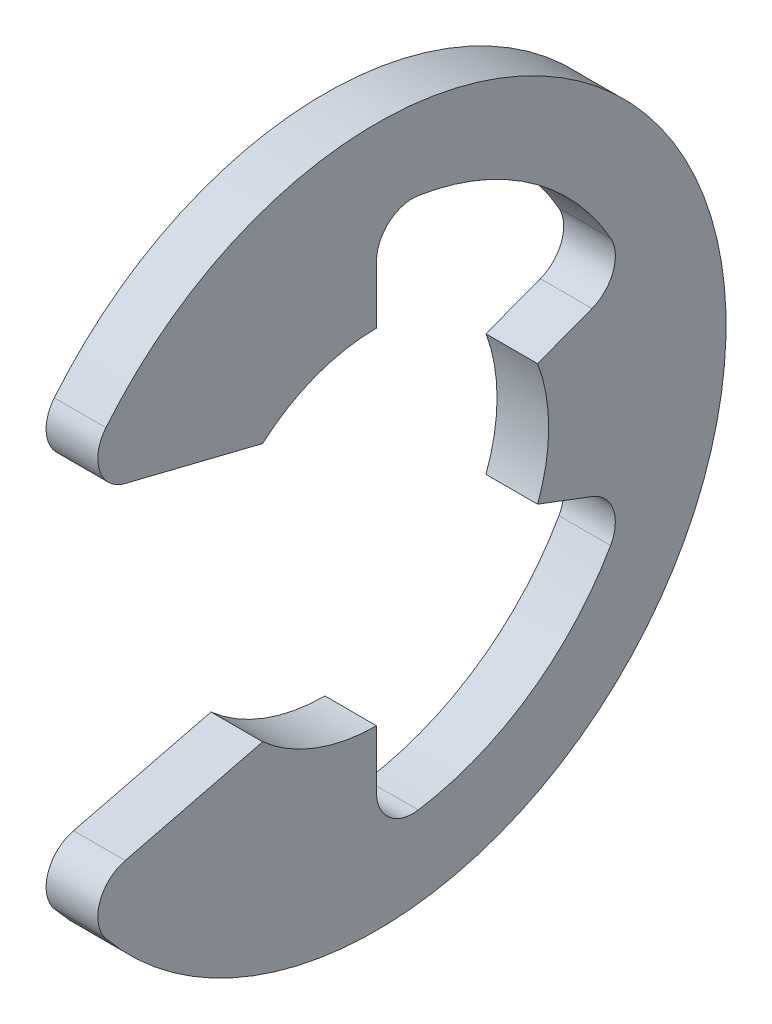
SolidWorks part; units mm, degrees
ref_plane "Front" through (0, 0, 0) normal (0, 0, 1) x (1, 0, 0)
ref_plane "Top" through (0, 0, 0) normal (0, 1, 0) x (1, 0, 0)
ref_plane "Right" through (0, 0, 0) normal (1, 0, 0) x (0, 0, -1)
sketch "Sketch1" plane through (0, 0, 0) normal (1, 0, 0) x (0, 0, -1)
  line L0 (-2.228, -1.2971) -> (-0.84, -0.9525)
  line L1 (-2.228, 1.2971) -> (-0.84, 0.9525)
  line L2 (0, -1.27) -> (0, -1.9861)
  line L3 (0, 1.27) -> (0, 1.9861)
  line L4 (1.188, -0.449) -> (1.8578, -0.7022)
  line L5 (1.188, 0.449) -> (1.8578, 0.7022)
  line L6 (0, 0) -> (-2.7305, 0) construction
  line L7 (1.188, 0.449) -> (1.188, -0.449) construction
  line L8 (0, -1.27) -> (-0.84, -0.9525) construction
  line L9 (0, 2.5781) -> (0, -2.5781) construction
  circle A1 centre (0, 0) radius 2.7305 construction
  circle A2 centre (0, 0) radius 1.27 construction
  arc A3 (-2.228, -1.2971) -> (-2.228, 1.2971) centre (0, 0) ccw
  arc A4 (-0.84, -0.9525) -> (0, -1.27) centre (0, 0) ccw
  arc A5 (-0.84, 0.9525) -> (0, 1.27) centre (0, 0) cw
  arc A6 (1.188, 0.449) -> (1.188, -0.449) centre (0, 0) cw
  arc A7 (0, -1.9861) -> (1.8578, -0.7022) centre (0, 0) ccw
  arc A8 (1.8578, 0.7022) -> (0, 1.9861) centre (0, 0) ccw
extrude "Extrude1" add sketch "Sketch1" along normal mid plane 0.381
fillet "Fillet1" radius 0.2667 6 edges at (0, -1.9861, 0) (0, 1.9861, 0) (0, -1.2971, 2.228) (0, 1.2971, 2.228) (0, -0.7022, -1.8578) (0, 0.7022, -1.8578)
sketch "Sketch3" plane through (0, 0, 0) normal (0, 1, 0) x (1, 0, 0)
  line L0 (0.254, 1.778) -> (0.254, 1.2954)
  line L1 (0.254, 1.2954) -> (-0.254, 1.2954)
  line L2 (-0.254, 1.2954) -> (-0.254, 1.778)
  line L3 (-0.254, 1.778) -> (-3.556, 1.778)
  line L4 (1.524, 0) -> (1.524, 1.5367)
  line L5 (-3.556, 1.778) -> (-3.556, 0)
  line L6 (-3.556, 0) -> (1.524, 0)
  line L8 (1.524, 0) -> (1.524, 1.778) construction
  line L9 (1.524, 1.778) -> (0.254, 1.778) construction
  line L10 (1.524, 0) -> (17.2631, 0) construction
  line L11 (1.524, 1.5367) -> (1.2827, 1.778)
  line L12 (1.2827, 1.778) -> (0.254, 1.778)
  point P2 (0, 1.2954)
  point P5 (0.254, 1.5367)
revolve "Revolve2" [suppressed] add sketch "Sketch3" angle 360 about L10
equation "\"D2@Sketch3\" = \"W@Sketch3\"*10"
equation "\"D1@Sketch3\" = \"D2@Sketch3\"/4"
equation "\"D1@Sketch1\" = (\"OD@Sketch1\"+\"D@Sketch1\")/3.875"
equation "\"D3@Sketch1\" = \"D@Sketch1\"*.75"
equation "\"D1@Fillet1\" = \"D1@Extrude1\"*.7"
